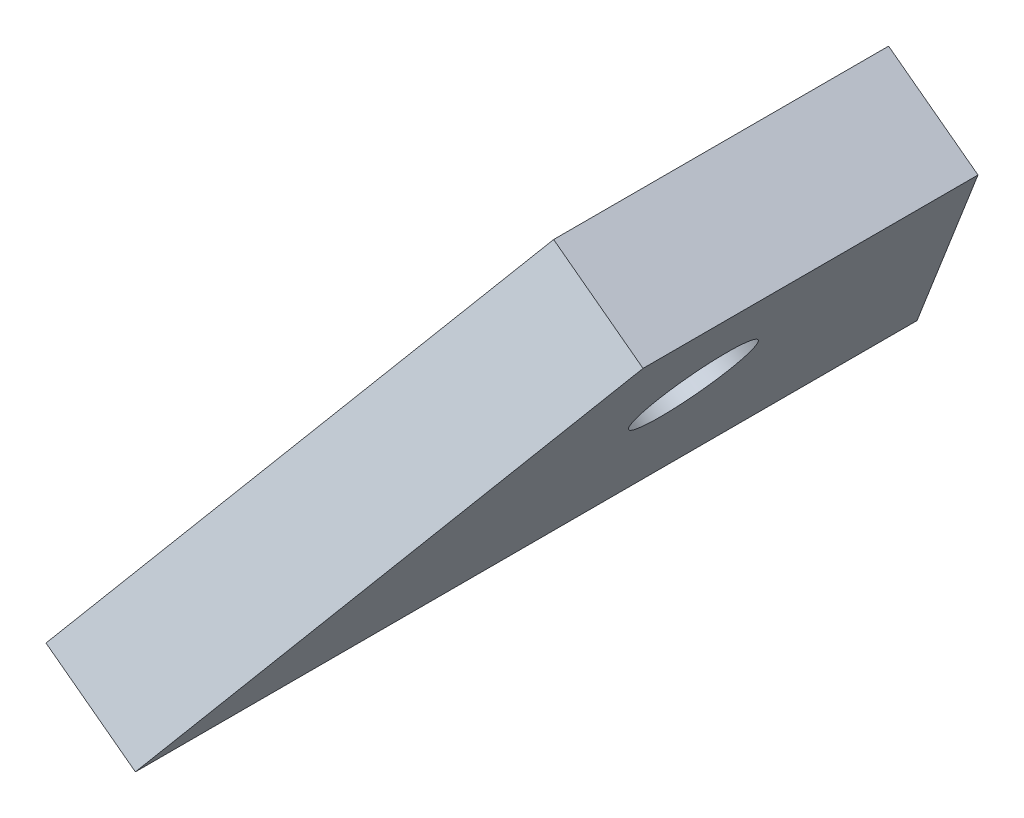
SolidWorks part; units mm, degrees
ref_plane "Alzado" through (0, 0, 0) normal (0, 0, 1) x (1, 0, 0)
ref_plane "Planta" through (0, 0, 0) normal (0, 1, 0) x (1, 0, 0)
ref_plane "Vista lateral" through (0, 0, 0) normal (1, 0, 0) x (0, 0, -1)
sketch3d "Sk_Plano_Yugo"
  point P0 (-234.5664, 351.3361, 0)
  point P1 (-234.5664, 351.3361, 10)
  point P2 (-228.5751, 359.3426, 0)
ref_plane "Plano_Yugo" through (-318.9017, 238.633, 0) normal (-0.8007, 0.5991, 0) x (0, 0, 1)
sketch "Sk_Yugo" plane through (-318.9017, 238.633, 0) normal (-0.8007, 0.5991, 0) x (0, 0, 1)
  line L0 (-14, 203.7638) -> (14, 203.7638)
  line L1 (14, 203.7638) -> (6, 220.7638)
  line L2 (6, 220.7638) -> (-6, 220.7638)
  line L3 (-6, 220.7638) -> (-14, 203.7638)
extrude "Yugo" add sketch "Sk_Yugo" along normal blind 4
sketch3d "Sk_Ojo_cable"
  line L0 (-190.0295, 409.1847, 0) -> (-194.8334, 412.7795, 0)
  dimension "D1" = 6
sweep "Ojo_cable" cut path "Sk_Ojo_cable" parameters "D3"=4
